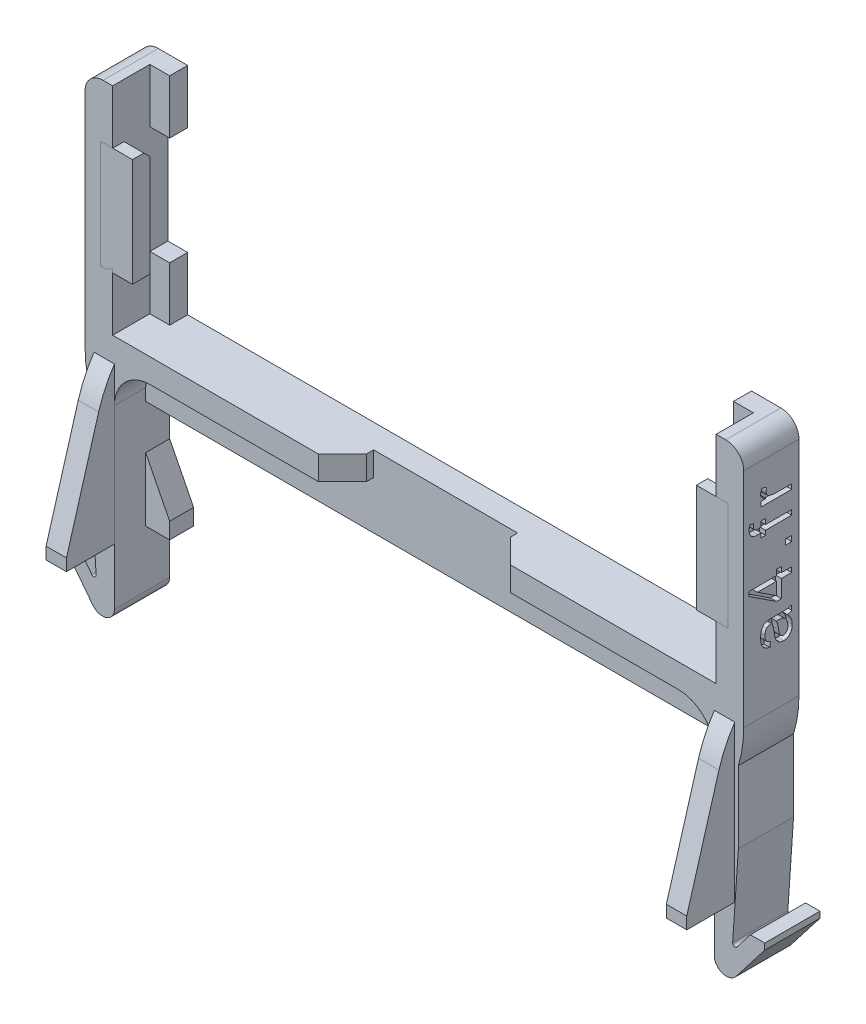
SolidWorks part; units mm, degrees
ref_plane "Plan de face" through (0, 0, 0) normal (0, 0, 1) x (1, 0, 0)
ref_plane "Plan de dessus" through (0, 0, 0) normal (0, 1, 0) x (1, 0, 0)
ref_plane "Plan de droite" through (0, 0, 0) normal (1, 0, 0) x (0, 0, -1)
sketch "Esquisse1" plane through (0, 0, 0) normal (0, 0, 1) x (1, 0, 0)
  line L0 (0, 45.8623) -> (0, -25.3342) construction
  line L1 (-45.5449, 0) -> (59.0505, 0) construction
  line L2 (25, 39.9971) -> (25, -16.0477) construction
  line L3 (28.8, 5.132) -> (28.8, -16.0477) construction
  line L4 (-25.1797, 13) -> (40.9663, 13) construction
  line L5 (-14.5898, 15) -> (40.9663, 15) construction
  line L6 (12.7376, -1.7) -> (69.1516, -1.7) construction
  line L7 (25, 13) -> (-25, 13)
  line L8 (25, 13) -> (25, -5.7)
  line L9 (25, -5.7) -> (26.5, -5.7)
  line L10 (29.2, -2.2148) -> (26.5, -5.7)
  line L11 (29.2, -2.2148) -> (29.2, -1.7)
  line L12 (27, 4) -> (27, 15)
  line L13 (27, 4) -> (26.5256, -3.0093)
  line L14 (28, -1.7) -> (26.8834, -3.1451)
  line L15 (27, 15) -> (-27, 15)
  line L16 (28, -1.7) -> (29.2, -1.7)
  line L17 (-28, -1.7) -> (-29.2, -1.7)
  line L18 (-28, -1.7) -> (-26.8834, -3.1451)
  line L19 (-27, 4) -> (-26.5256, -3.0093)
  line L20 (-27, 4) -> (-27, 15)
  line L21 (-29.2, -2.2148) -> (-29.2, -1.7)
  line L22 (-29.2, -2.2148) -> (-26.5, -5.7)
  line L23 (-25, -5.7) -> (-26.5, -5.7)
  line L24 (-25, 13) -> (-25, -5.7)
  arc A0 (26.5256, -3.0093) -> (26.8834, -3.1451) centre (26.7251, -3.0228) ccw
  arc A1 (-26.5256, -3.0093) -> (-26.8834, -3.1451) centre (-26.7251, -3.0228) cw
  point P22 (26.4812, -3.6657)
  point P26 (26.4, -4.7)
  point P31 (29.2, 0.3)
  point P35 (-29.2, 0.3)
  point P36 (-26.4, -4.7)
  point P40 (0, 15)
  point P41 (0, 15)
  point P45 (0, 13)
  point P47 (0, 13)
  dimension "D15" = 1.2
  dimension "D17" = 1.3228
  dimension "D10" = 0.2
  dimension "D1" = 25
  dimension "D2" = 3.8
  dimension "D3" = 13
  dimension "D4" = 2
  dimension "D5" = 1.7
  dimension "D6" = 4
  dimension "D7" = 2
  dimension "D8" = 4
  dimension "D9" = 3
  dimension "D11" = 0.5148
  dimension "D12" = 0.4
  dimension "D13" = 1.5
  dimension "D14" = 6
  dimension "D16" = 1.7251
extrude "Boss.-Extru.1" add sketch "Esquisse1" along normal blind 4.6
sketch "Esquisse2" plane through (0, 0, 0) normal (0, 0, -1) x (-1, 0, 0)
  line L0 (0, 20) -> (0, -12.196) construction
  line L1 (-27, 20) -> (27, 20) construction
  line L2 (25, 5.3) -> (25, 9)
  line L3 (26, 0) -> (23, 0)
  line L4 (25, -5.7) -> (25, 13) construction
  line L5 (23, 0) -> (23, 1.3466)
  line L6 (23, 1.3466) -> (25, 5.3)
  line L7 (25, 9) -> (-25, 9)
  line L10 (26.5, -5.7) -> (25, -5.7) construction
  line L12 (-25, 13) -> (-25, -5.7) construction
  line L13 (26, 14.0631) -> (-26, 14.0631)
  line L14 (-26, 14.0631) -> (-26, 0)
  line L15 (-23, 1.3466) -> (-25, 5.3)
  line L16 (26, 14.0631) -> (26, 0)
  line L17 (-23, 0) -> (-23, 1.3466)
  line L18 (-26, 0) -> (-23, 0)
  line L19 (25, 13) -> (-25, 13) construction
  line L20 (-25, 9) -> (-25, 5.3)
  point P13 (25.75, -5.7)
  point P21 (0, 14.0631)
  point P22 (0, 9)
  dimension "D1" = 5.7
  dimension "D2" = 2
  dimension "D3" = 7.0466
  dimension "D4" = 11
  dimension "D5" = 4
  dimension "D6" = 1
  dimension "D7" = 1.0631
extrude "Boss.-Extru.2" add sketch "Esquisse2" against normal blind 2
sketch "Esquisse3" plane through (0, 0, 0) normal (0, 0, -1) x (-1, 0, 0)
  line L0 (0, 14) -> (0, 63.4526) construction
  line L1 (-22, 14) -> (22, 14) construction
  line L2 (13.9505, 45) -> (-70.5415, 45) construction
  line L3 (-27, 20) -> (27, 20) construction
  line L4 (-27, 9.5) -> (-27, 51.0458) construction
  line L5 (-27, 4) -> (-27, 15) construction
  line L6 (-25, 7.8369) -> (-25, 47.3165) construction
  line L7 (-25, 13) -> (-25, -5.7) construction
  line L8 (-15.6739, 20) -> (-35.3148, 20) construction
  line L9 (-18.6398, 33) -> (-37.4239, 33) construction
  line L10 (27.45, 33) -> (27.45, 10)
  line L11 (-25.15, 33) -> (-27.45, 33)
  line L12 (-25.15, 33) -> (-25.15, 10)
  line L13 (-25.15, 10) -> (-27.45, 10)
  line L14 (-27.45, 33) -> (-27.45, 10)
  line L15 (25.15, 10) -> (27.45, 10)
  line L16 (25.15, 33) -> (25.15, 10)
  line L17 (25.15, 33) -> (27.45, 33)
  line L18 (-27, 15) -> (27, 15) construction
  dimension "D5" = 10
  dimension "D1" = 18
  dimension "D3" = 0.3
  dimension "D4" = 2.3
extrude "Boss.-Extru.3" add sketch "Esquisse3" against normal up to surface (4.6 mm away)
sketch "Esquisse4" plane through (0, 0, 0) normal (0, 0, -1) x (-1, 0, 0)
  line L0 (0, 36.8708) -> (0, 3.8853) construction
  line L1 (26.3, 33) -> (18.5882, 33) construction
  line L2 (25.15, 33) -> (25.15, 15) construction
  line L3 (26.0029, 33) -> (23.5, 33)
  line L5 (21.0285, 15) -> (28.7845, 15) construction
  line L6 (-25.15, 15) -> (25.15, 15) construction
  line L8 (27.45, 33) -> (25.15, 33) construction
  line L10 (23.5, 15) -> (26.0029, 15)
  line L11 (-26.0029, 33) -> (-23.5, 33)
  line L12 (23.5, 33) -> (23.5, 15)
  line L13 (-23.5, 15) -> (-26.0029, 15)
  line L14 (26.0029, 15) -> (26.0029, 33)
  line L15 (-26.0029, 15) -> (-26.0029, 33)
  line L16 (-23.5, 33) -> (-23.5, 15)
  dimension "D1" = 1.65
  dimension "D2" = 0.8529
extrude "Boss.-Extru.4" add sketch "Esquisse4" against normal blind 1.5
ref_plane "Plan1" through (0, 0, 3.15) normal (0, 0, 1) x (1, 0, 0)
sketch "Esquisse5" plane through (0, 0, 3.15) normal (0, 0, 1) x (1, 0, 0)
  line L0 (25.15, 15) -> (-25.15, 15) construction
  line L1 (25.15, 21.0996) -> (25.15, 44.5343) construction
  line L2 (23.5, 28.5) -> (26.15, 28.5)
  line L3 (25.15, 33) -> (25.15, 15) construction
  line L4 (23.5, 21.6272) -> (23.5, 39.4364) construction
  line L5 (23.5, 15) -> (23.5, 38) construction
  line L7 (23.5, 28.5) -> (23.5, 19.5)
  line L8 (0, 14) -> (0, 40.56) construction
  line L9 (22, 14) -> (-22, 14) construction
  line L10 (23.5, 19.5) -> (26.15, 19.5)
  line L11 (26.15, 28.5) -> (26.15, 19.5)
  line L12 (-26.15, 28.5) -> (-26.15, 19.5)
  line L13 (-23.5, 19.5) -> (-26.15, 19.5)
  line L14 (-23.5, 28.5) -> (-23.5, 19.5)
  line L15 (-23.5, 28.5) -> (-26.15, 28.5)
  line L16 (23.5, 41.1201) -> (23.5, 23.9089) construction
  dimension "D1" = 9
  dimension "D2" = 4.5
  dimension "D3" = 1.65
  dimension "D4" = 1
extrude "Boss.-Extru.5" add sketch "Esquisse5" along normal up to surface (1.45 mm away) separate body
sketch "Esquisse7" plane through (0, 0, 4.6) normal (0, 0, 1) x (1, 0, 0)
  line L0 (-1.0534, 0) -> (40.2279, 0) construction
  line L1 (25, 9.2296) -> (25, -18.7038) construction
  line L2 (25, 13) -> (25, -5.7) construction
  line L3 (0, 20) -> (0, 5.8383) construction
  line L4 (25, 0) -> (26.7, 0)
  line L5 (25, 0) -> (25, 13)
  line L6 (25, 13) -> (26.7, 13)
  line L7 (26.7, 0) -> (26.7, 13)
  line L8 (25, 20) -> (-25, 20) construction
  line L9 (-26.7, 0) -> (-26.7, 13)
  line L10 (-25, 13) -> (-26.7, 13)
  line L11 (-25, 0) -> (-25, 13)
  line L12 (-25, 0) -> (-26.7, 0)
  dimension "D1" = 13
  dimension "D2" = 1.7
extrude "Boss.-Extru.6" add sketch "Esquisse7" along normal blind 4
fillet "Congé2" radius 10 2 edges at (-27.45, 10, 2.3) (27.45, 10, 2.3)
chamfer "Chanfrein1" distance 3.5 distance2 12 1 edges at (-25.85, 13, 8.6)
chamfer "Chanfrein2" distance 3.5 distance2 12 1 edges at (25.85, 13, 8.6)
chamfer "Chanfrein3" distance 0.5 angle 45 1 edges at (24.825, 28.5, 3.15)
chamfer "Chanfrein4" distance 0.5 angle 45 1 edges at (-24.825, 28.5, 3.15)
fillet "Congé3" radius 10 1 edges at (-25.85, 13, 5.1)
fillet "Congé4" radius 10 1 edges at (25.85, 13, 5.1)
fillet "Congé5" radius 1.5 2 edges at (27.45, 33, 2.3) (-27.45, 33, 2.3)
fillet "Congé6" radius 3 2 edges at (25, 13, 3.3) (-25, 13, 3.3)
fillet "Congé7" radius 1 2 edges at (25, -5.7, 2.3) (-25, -5.7, 2.3)
fillet "Congé8" radius 1 2 edges at (26.5, -5.7, 2.3) (-26.5, -5.7, 2.3)
sketch "Esquisse8" plane through (0, 0, 4.6) normal (0, 0, 1) x (1, 0, 0)
  line L0 (0, 14) -> (0, 28.9661) construction
  line L1 (22, 14) -> (-22, 14) construction
  line L2 (25.15, 15) -> (-25.15, 15) construction
  line L3 (-6, 16) -> (6, 16)
  line L4 (-6, 16) -> (-6, 12)
  line L5 (-6, 12) -> (6, 12)
  line L6 (6, 16) -> (6, 12)
  line L7 (-6, 16) -> (6, 12) construction
  line L8 (-6, 12) -> (6, 16) construction
  point P5 (0, 14)
  dimension "D1" = 12
  dimension "D2" = 4
  dimension "D3" = 1
extrude "Enlèv. mat.-Extru.1" cut sketch "Esquisse8" against normal up to surface (2.6 mm away)
sketch "Esquisse9" plane through (0, 0, 1.5) normal (0, 0, 1) x (1, 0, 0)
  line L0 (0, 15) -> (0, 41.6541) construction
  line L1 (-6, 15) -> (6, 15) construction
  line L2 (21.782, 28.5) -> (32.1604, 28.5) construction
  line L3 (21.5178, 19.5) -> (31.3301, 19.5) construction
  line L4 (25.15, 22.4559) -> (25.15, 41.6541) construction
  line L5 (25.15, 15) -> (25.15, 33) construction
  line L6 (25.15, 15) -> (6, 15) construction
  line L7 (25.15, 19.5) -> (22.65, 19.5)
  line L8 (25.15, 19.5) -> (25.15, 28.5)
  line L9 (25.15, 28.5) -> (22.65, 28.5)
  line L10 (22.65, 19.5) -> (22.65, 28.5)
  line L11 (-22.65, 19.5) -> (-22.65, 28.5)
  line L12 (-25.15, 28.5) -> (-22.65, 28.5)
  line L13 (-25.15, 19.5) -> (-25.15, 28.5)
  line L14 (-25.15, 19.5) -> (-22.65, 19.5)
  dimension "D1" = 2.5
  dimension "D2" = 9
  dimension "D3" = 4.5
extrude "Enlèv. mat.-Extru.2" cut sketch "Esquisse9" against normal blind 10
chamfer "Chanfrein5" distance 2 angle 45 2 edges at (-6, 14, 4.6) (6, 14, 4.6)
sketch "Esquisse10" plane through (27.45, 0, 0) normal (1, 0, 0) x (0, 0, -1)
  line L0 (-0.6031, 17.4037) -> (-0.6031, 30.883) construction
  text T0 "a4.fr" font "Arial Narrow" height 3.5
extrude "Enlèv. mat.-Extru.3" cut sketch "Esquisse10" against normal blind 0.5
